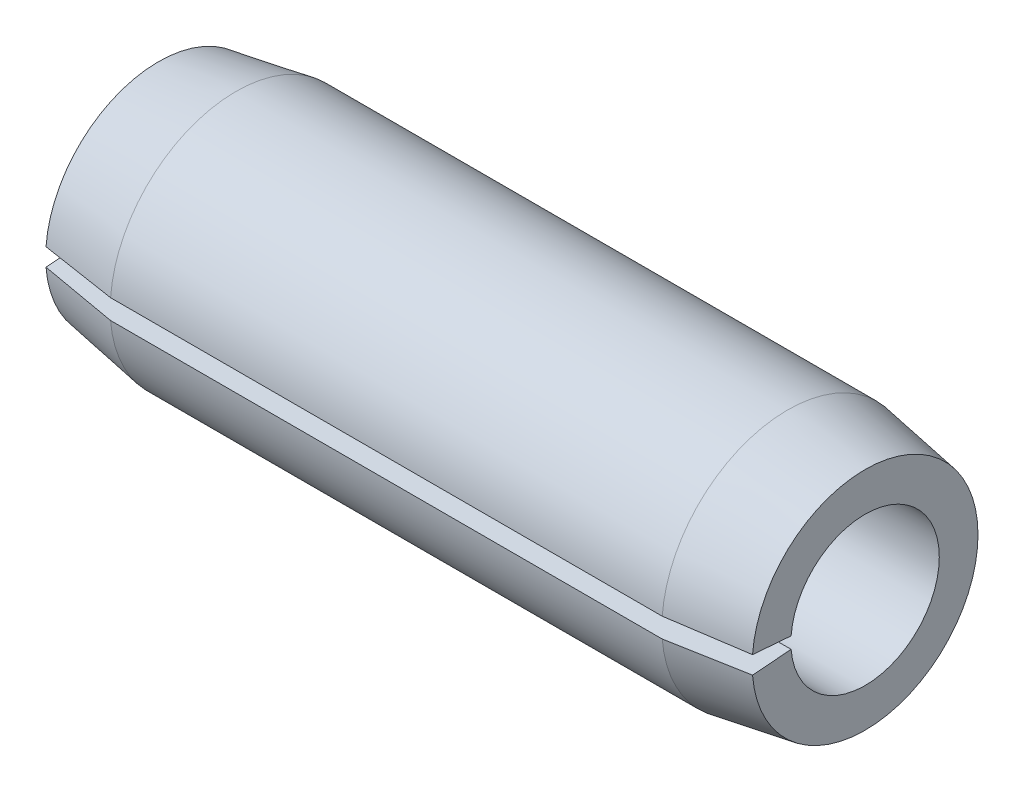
SolidWorks part; units mm, degrees
ref_plane "Plane1" through (0, 0, 0) normal (0, 0, 1) x (1, 0, 0)
ref_plane "Plane2" through (0, 0, 0) normal (0, 1, 0) x (1, 0, 0)
ref_plane "Plane3" through (0, 0, 0) normal (1, 0, 0) x (0, 0, -1)
sketch "Sketch1" plane through (0, 0, 0) normal (0, 0, 1) x (1, 0, 0)
  line L0 (-9.525, 0) -> (111.125, 0) construction
  line L1 (0, 1.1684) -> (11.1252, 1.1684)
  line L2 (11.1252, 1.1684) -> (11.1252, 1.778)
  line L3 (11.1252, 1.778) -> (9.906, 1.9812)
  line L4 (9.906, 1.9812) -> (1.2192, 1.9812)
  line L5 (1.2192, 1.9812) -> (0, 1.778)
  line L7 (0, 1.778) -> (0, 1.1684)
  dimension "Diameter" = 3.9624
  dimension "Length" = 11.1252
  dimension "Thickness" = 0.8128
  dimension "Top_ch_len" = 1.2192
  dimension "Bottom_ch_len" = 1.2192
  dimension "Bottom_ch_dia" = 3.556
  dimension "Top_ch_dia" = 3.556
revolve "Base-Revolve" add sketch "Sketch1" angle 360 about L0
sketch "Sketch2" plane through (0, 0, 0) normal (-1, 0, 0) x (0, -1, 0)
  line L0 (0, 0) -> (0.1586, 2.0146)
  line L1 (0, -3.175) -> (0, 12.7) construction
  line L2 (0, 0) -> (-0.1586, 2.0146)
  arc A0 (0.1586, 2.0146) -> (-0.1586, 2.0146) centre (0, 0) ccw
  dimension "D1" = 2.0208
  dimension "Gap_ang" = 9
extrude "Gap" cut sketch "Sketch2" against normal through all
equation "\"D1@Sketch2\" = \"Diameter@Sketch1\" * 0.51"
equation "' \"Bottom_ch_dia@Sketch1\" = \"Diameter@Sketch1\" -  ( \"Thickness@Sketch1\" / 2 ) "
equation "' \"Top_ch_dia@Sketch1\" = \"Bottom_ch_dia@Sketch1\""
equation "' \"Top_ch_len@Sketch1\" = \"Bottom_ch_len@Sketch1\""
